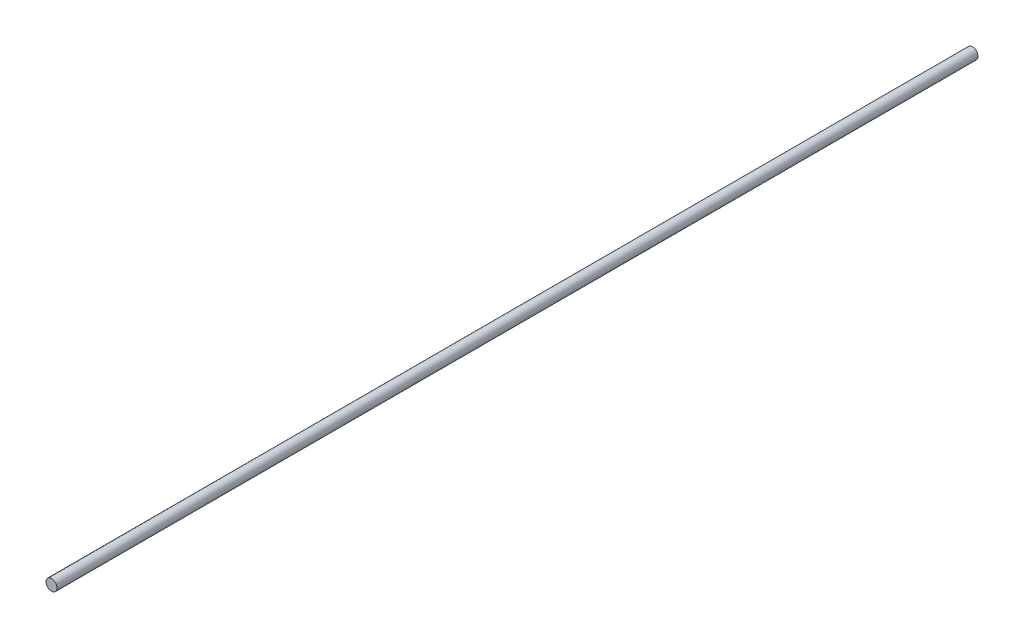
SolidWorks part; units mm, degrees
ref_plane "Front Plane" through (0, 0, 0) normal (0, 0, 1) x (1, 0, 0)
ref_plane "Top Plane" through (0, 0, 0) normal (0, 1, 0) x (1, 0, 0)
ref_plane "Right Plane" through (0, 0, 0) normal (1, 0, 0) x (0, 0, -1)
sketch "Sketch1" plane through (0, 0, 0) normal (0, 0, 1) x (1, 0, 0)
  circle A0 centre (0, 0) radius 30
  dimension "D1" = 60
extrude "Boss-Extrude1" add sketch "Sketch1" against normal blind 5000
